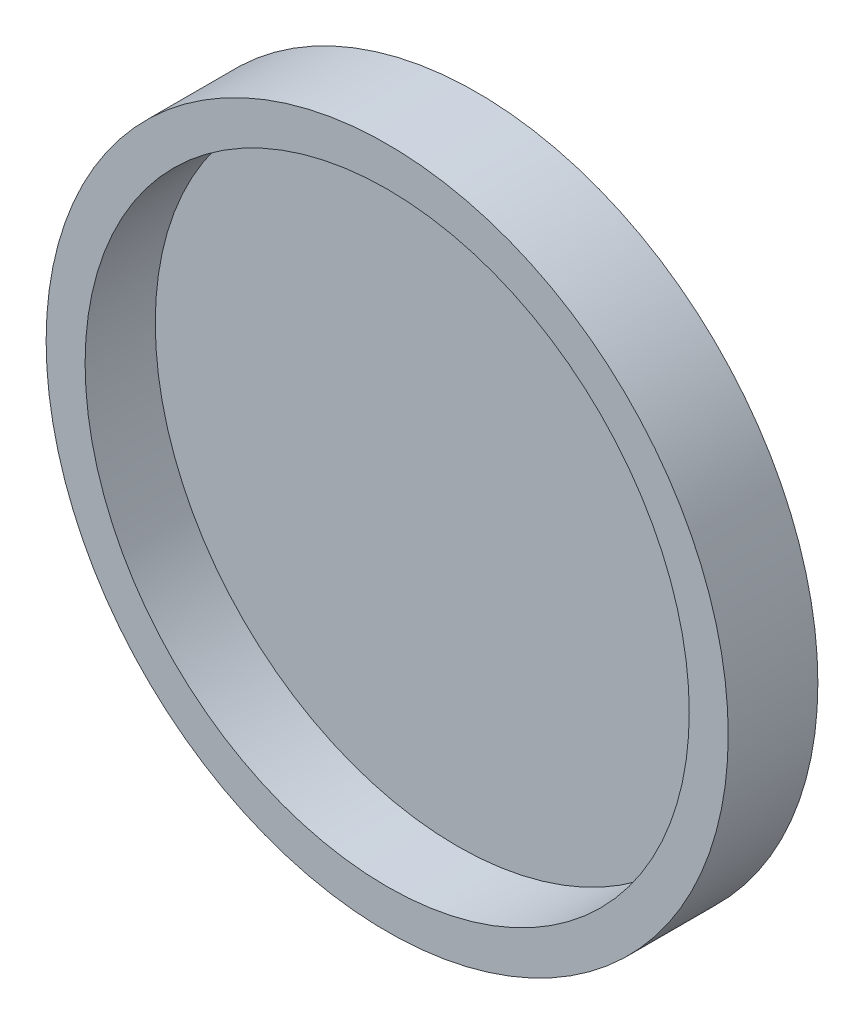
SolidWorks part; units mm, degrees
ref_plane "Front Plane" through (0, 0, 0) normal (0, 0, 1) x (1, 0, 0)
ref_plane "Top Plane" through (0, 0, 0) normal (0, 1, 0) x (1, 0, 0)
ref_plane "Right Plane" through (0, 0, 0) normal (1, 0, 0) x (0, 0, -1)
sketch "Sketch1" plane through (0, 0, 0) normal (0, 0, 1) x (1, 0, 0)
  circle A0 centre (0, 0) radius 17.5
  dimension "D1" = 35
extrude "Boss-Extrude1" add sketch "Sketch1" along normal blind 4.6 contours A0
sketch "Sketch2" plane through (0, 0, 4.6) normal (0, 0, 1) x (1, 0, 0)
  circle A0 centre (0, 0) radius 15.5
  dimension "D1" = 31
extrude "Cut-Extrude1" cut sketch "Sketch2" against normal blind 3.6
